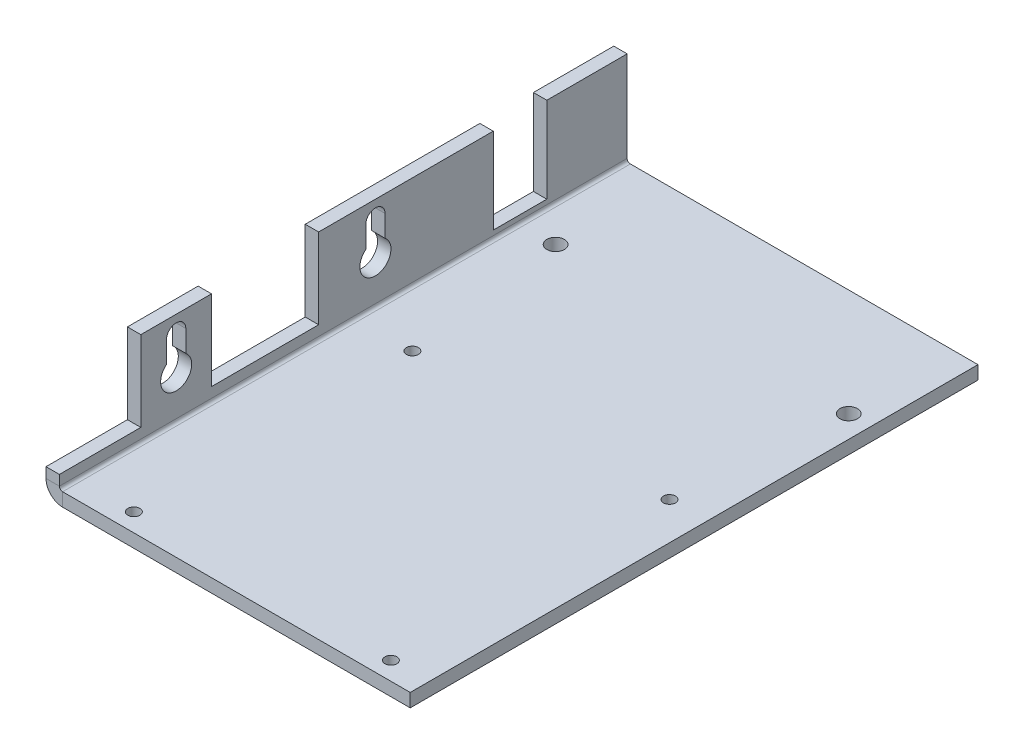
SolidWorks part; units mm, degrees
ref_plane "Front" through (0, 0, 0) normal (0, 0, 1) x (1, 0, 0)
ref_plane "Top" through (0, 0, 0) normal (0, 1, 0) x (1, 0, 0)
ref_plane "Right" through (0, 0, 0) normal (1, 0, 0) x (0, 0, -1)
sketch "Sketch1" plane through (0, 0, 0) normal (0, 0, 1) x (1, 0, 0)
  line L0 (-43.18, 0) -> (-43.18, 25.4)
  line L3 (-43.18, 0) -> (43.18, 0)
  dimension "D1" = 25.4
  dimension "D2" = 86.36
extrude "Base-Extrude-Thin" add sketch "Sketch1" against normal blind 134.62 thin
hole_wizard "#4-40 Tapped Hole2" positions "Sketch7" profile "Sketch6" tap size "#4-40" standard "Ansi Inch"
sketch "Sketch7" plane through (0, 3.175, 0) normal (0, 1, 0) x (-1, 0, 0)
  line L0 (-47.7032, -109.22) -> (50.0697, -109.22) construction
  line L1 (40.005, -134.62) -> (-43.18, -134.62) construction
  line L2 (-43.18, -134.62) -> (-43.18, 0) construction
  line L3 (-47.7032, -70.358) -> (48.9487, -70.358) construction
  line L5 (-58.0564, -37.338) -> (63.069, -37.338) construction
  point P12 (-34.29, -70.358)
  point P13 (26.67, -70.358)
  point P16 (26.67, -4.318)
  point P17 (-34.29, -4.318)
  dimension "D1" = 25.4
  dimension "D3" = 64.262
  dimension "D4" = 60.96
  dimension "D6" = 33.02
  dimension "D7" = 8.89
sketch "Sketch6" plane through (34.29, 3.175, -70.358) normal (1, 0, 0) x (0, 0, 1)
  line L0 (0, 0) -> (0, 3.175)
  line L1 (0, 3.175) -> (1.1303, 3.175)
  line L3 (1.1303, 3.175) -> (1.1303, 5.6896)
  line L4 (1.1303, 5.6896) -> (1.4224, 5.6896)
  line L5 (1.4224, 5.6896) -> (1.4224, 0)
  line L7 (1.4224, 0) -> (0, 0)
  line L11 (0, -6.35) -> (0, 107.95) construction
  dimension "Thru Tap Drill Dia." = 2.2606
  dimension "Thru Tap Drill Depth" = 3.175
  dimension "Thread Dia." = 2.8448
  dimension "Thread Depth" = 5.6896
hole_wizard "#8-32 Tapped Hole1"
sketch "Sketch13"
  line L0 (-50.0252, -109.22) -> (68.1396, -109.22) construction
  line L1 (40.005, -134.62) -> (-43.18, -134.62) construction
  line L2 (-43.18, -134.62) -> (-43.18, 0) construction
  point P5 (-37.9222, -109.22)
  point P6 (31.5722, -109.22)
bend "SharpBend1" bend angle 90 parameters "D1"=0, "D5"=1, "D2"=134.62, "D3"=53.1931
sketch "Sketch12" plane through (37.9222, 3.175, -109.22) normal (1, 0, 0) x (0, 0, 1)
  line L0 (0, 0) -> (0, 3.175)
  line L1 (0, 3.175) -> (1.7272, 3.175)
  line L3 (1.7272, 3.175) -> (1.7272, 8.3312)
  line L4 (1.7272, 8.3312) -> (2.0828, 8.3312)
  line L5 (2.0828, 8.3312) -> (2.0828, 0)
  line L7 (2.0828, 0) -> (0, 0)
  line L11 (0, -6.35) -> (0, 107.95) construction
  dimension "Thru Tap Drill Dia." = 3.4544
  dimension "Thru Tap Drill Depth" = 3.175
  dimension "Thread Dia." = 4.1656
  dimension "Thread Depth" = 8.3312
sketch "Sketch10" plane through (-40.005, 0, 0) normal (1, 0, 0) x (0, 0, -1)
  line L0 (-4.8028, 21.336) -> (104.9521, 21.336) construction
  line L1 (134.62, 25.4) -> (0, 25.4) construction
  line L2 (27.686, 30.9488) -> (27.686, -5.3514) construction
  line L3 (134.62, 0) -> (0, 0) construction
  line L4 (29.972, 21.336) -> (29.972, 16.2227)
  line L5 (25.4, 21.336) -> (25.4, 16.2227)
  line L6 (51.308, 34.5789) -> (51.308, 4.2869) construction
  line L7 (77.216, 21.336) -> (77.216, 16.2227)
  line L8 (72.644, 21.336) -> (72.644, 16.2227)
  line L9 (134.62, 25.4) -> (134.62, 3.175) construction
  arc A0 (29.972, 21.336) -> (25.4, 21.336) centre (27.686, 21.336) ccw
  arc A1 (25.4, 16.2227) -> (29.972, 16.2227) centre (27.686, 13.335) ccw
  circle A2 centre (27.686, 21.336) radius 3.302 construction
  circle A3 centre (74.93, 21.336) radius 3.302 construction
  arc A4 (77.216, 16.2227) -> (72.644, 16.2227) centre (74.93, 13.335) cw
  arc A5 (72.644, 21.336) -> (77.216, 21.336) centre (74.93, 21.336) cw
  dimension "D2" = 4.572
  dimension "D3" = 7.366
  dimension "D5" = 6.604
  dimension "D1" = 4.064
  dimension "D4" = 106.934
  dimension "D6" = 83.312
  dimension "D7" = 13.335
extrude "Cut-Extrude3" cut sketch "Sketch10" against normal through all
sketch "Sketch11" plane through (-43.18, 0, 0) normal (-1, 0, 0) x (0, 0, 1)
  line L0 (-109.22, 36.715) -> (-109.22, -15.0002) construction
  line L2 (-134.62, 25.4) -> (0, 25.4) construction
  line L3 (-115.57, 5.08) -> (-102.87, 45.72) construction
  line L4 (-115.57, 45.72) -> (-102.87, 45.72)
  line L5 (-115.57, 45.72) -> (-115.57, 5.08)
  line L6 (-115.57, 5.08) -> (-102.87, 5.08)
  line L7 (-102.87, 45.72) -> (-102.87, 5.08)
  line L8 (-48.768, 51.491) -> (-48.768, -15.0002) construction
  line L9 (-6.604, 49.6465) -> (-6.604, -15.0002) construction
  line L10 (-134.62, 25.4) -> (-134.62, 0) construction
  line L11 (-61.468, 6.35) -> (-36.068, 44.45) construction
  line L12 (-61.468, 44.45) -> (-36.068, 44.45)
  line L13 (-61.468, 44.45) -> (-61.468, 6.35)
  line L14 (-61.468, 6.35) -> (-36.068, 6.35)
  line L15 (-36.068, 44.45) -> (-36.068, 6.35)
  line L16 (-19.304, 44.45) -> (6.096, 44.45)
  line L17 (-19.304, 44.45) -> (-19.304, 6.35)
  line L18 (-19.304, 6.35) -> (6.096, 6.35)
  line L19 (6.096, 44.45) -> (6.096, 6.35)
  line L20 (-19.304, 6.35) -> (6.096, 44.45) construction
  line L21 (-109.22, 0) -> (-109.22, 3.175) construction
  point P4 (-109.22, 25.4)
  point P25 (-48.768, 25.4)
  point P26 (-6.604, 25.4)
  dimension "D1" = 20.32
  dimension "D2" = 12.7
  dimension "D3" = 85.852
  dimension "D4" = 128.016
  dimension "D5" = 25.4
  dimension "D6" = 19.05
extrude "Cut-Extrude4" cut sketch "Sketch11" against normal through all
sheet metal parameters "Sheet-Metal1" parameters "D1"=0.762
flatten bends "Flatten-Bends1" parameters "D1"=0
sketch "Sharp-Sketch1" plane through (0, 3.175, 0) normal (0, 1, 0) x (-1, 0, 0)
  line L0 (41.0883, -134.62) -> (41.0883, 0) construction
process bends "Process-Bends1" parameters "D1"=0
sketch "Flat-Sketch1" plane through (0, 3.175, 0) normal (0, 1, 0) x (-1, 0, 0)
